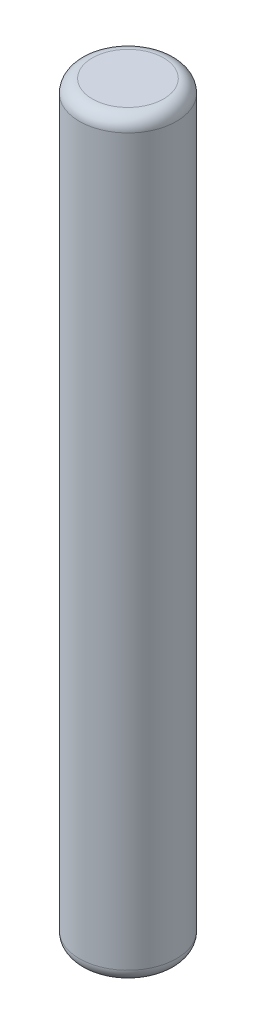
SolidWorks part; units mm, degrees
ref_plane "Спереди" through (0, 0, 0) normal (0, 0, 1) x (1, 0, 0)
ref_plane "Сверху" through (0, 0, 0) normal (0, 1, 0) x (1, 0, 0)
ref_plane "Справа" through (0, 0, 0) normal (1, 0, 0) x (0, 0, -1)
sketch "Эскиз1" plane through (0, 0, 0) normal (0, 1, 0) x (1, 0, 0)
  circle A0 centre (0, 0) radius 0.375
  dimension "D1" = 0.75
extrude "Бобышка-Вытянуть1" add sketch "Эскиз1" along normal blind 5.8
fillet "Скругление1" radius 0.1 2 edges at (0, 0, 0.375) (0, 5.8, 0.375)
